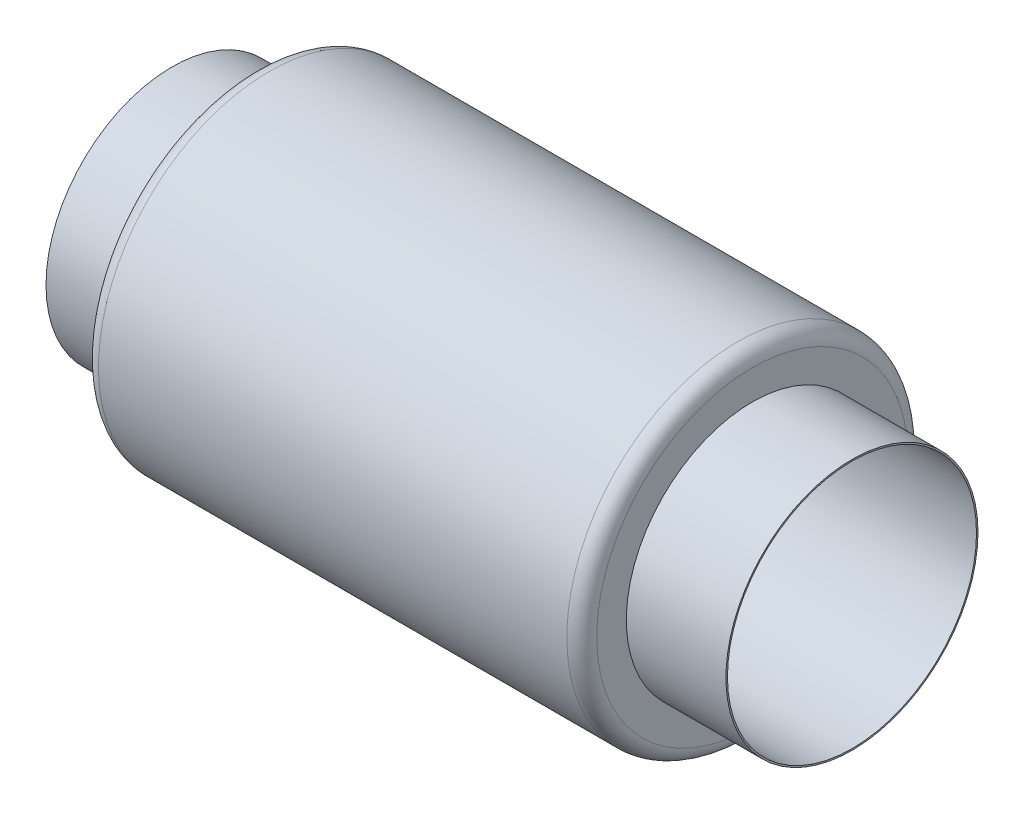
SolidWorks part; units mm, degrees
ref_plane "Front Plane" through (0, 0, 0) normal (0, 0, 1) x (1, 0, 0)
ref_plane "Top Plane" through (0, 0, 0) normal (0, 1, 0) x (1, 0, 0)
ref_plane "Right Plane" through (0, 0, 0) normal (1, 0, 0) x (0, 0, -1)
sketch "Sketch1" plane through (0, 0, 0) normal (1, 0, 0) x (0, 0, -1)
  circle A0 centre (0, 0) radius 12.8524
  circle A1 centre (0, 0) radius 12.7
  dimension "D1" = 25.7048
  dimension "D2" = 25.4
extrude "Boss-Extrude1" add sketch "Sketch1" along normal blind 88.9
ref_plane "Plane1" through (19.05, 0, 0) normal (1, 0, 0) x (0, 0, -1)
sketch "Sketch2" plane through (19.05, 0, 0) normal (1, 0, 0) x (0, 0, -1)
  circle A0 centre (0, 0) radius 17.399
  circle A1 centre (0, 0) radius 12.809
  dimension "D1" = 34.798
extrude "Boss-Extrude2" add sketch "Sketch2" along normal blind 50.8
fillet "Fillet1" radius 1.524 2 edges at (69.85, 0, -17.399) (19.05, 0, -17.399)
sketch "Sketch3" plane through (0, 0, 0) normal (-1, 0, 0) x (0, 0, 1)
  line L1 (-24.4125, 18.9633) -> (22.5102, 18.9633)
  line L2 (-24.4125, 18.9633) -> (-24.4125, -18.3292)
  line L3 (-24.4125, -18.3292) -> (22.5102, -18.3292)
  line L4 (22.5102, 18.9633) -> (22.5102, -18.3292)
extrude "Cut-Extrude1" cut sketch "Sketch3" against normal blind 10.668
sketch "Sketch4" plane through (88.9, 0, 0) normal (1, 0, 0) x (0, 0, -1)
  line L1 (-27.0272, 23.3988) -> (26.0559, 23.3988)
  line L2 (-27.0272, 23.3988) -> (-27.0272, -19.9704)
  line L3 (-27.0272, -19.9704) -> (26.0559, -19.9704)
  line L4 (26.0559, 23.3988) -> (26.0559, -19.9704)
extrude "Cut-Extrude2" cut sketch "Sketch4" against normal blind 8.89
